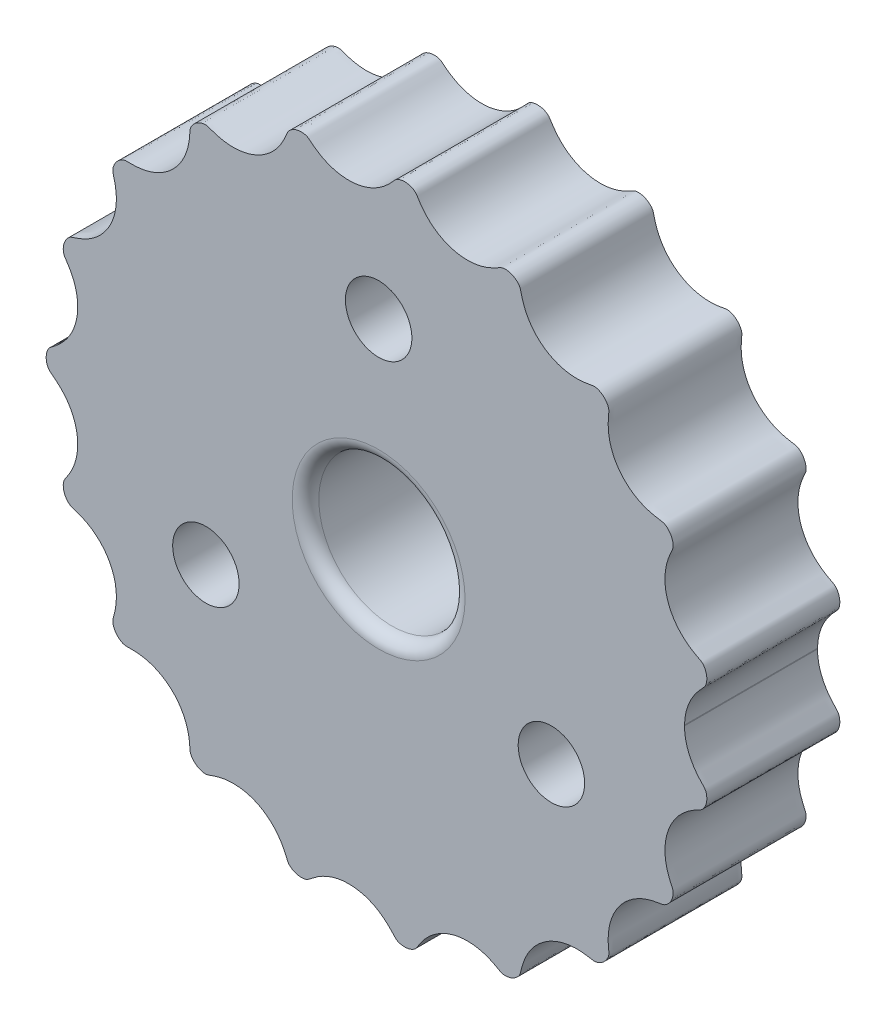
SolidWorks part; units mm, degrees
ref_plane "Ebene vorne" through (0, 0, 0) normal (0, 0, 1) x (1, 0, 0)
ref_plane "Ebene oben" through (0, 0, 0) normal (0, 1, 0) x (1, 0, 0)
ref_plane "Ebene rechts" through (0, 0, 0) normal (1, 0, 0) x (0, 0, -1)
sketch "Skizze1" plane through (0, 0, 0) normal (0, 0, 1) x (1, 0, 0)
  circle A0 centre (0, 0) radius 25
  dimension "D1" = 50
extrude "Aufsatz-Linear austragen1" add sketch "Skizze1" along normal blind 10 contours A0
sketch "Skizze3" plane through (0, 0, 10) normal (0, 0, 1) x (1, 0, 0)
  circle A0 centre (0, 25) radius 0.5
  circle A1 centre (0, 0) radius 25 construction
extrude "Schnitt-Linear austragen1" cut sketch "Skizze3" against normal up to next contours A0
pattern_circular "Kreismuster3" [suppressed] count 30 over 360
sketch "Skizze9" plane through (0, 0, 10) normal (0, 0, 1) x (1, 0, 0)
  line L0 (23.0004, 0.0609) -> (23, 0)
  spline S0 degree 4 number of poles 711 (21.8349, 10.4363) -> (21.8113, -10.3736) construction
  spline S1 degree 4 number of poles 634 (23, 0) -> (23.0004, 0.0609)
extrude "Schnitt-Linear austragen6" cut sketch "Skizze9" against normal blind 10 flip side to cut
sketch "Skizze21" plane through (0, 0, 0) normal (0, 0, -1) x (-1, 0, 0)
  circle A0 centre (0, 0) radius 5.5
  dimension "D1" = 11
extrude "Schnitt-Linear austragen11" cut sketch "Skizze21" against normal blind 10
sketch "Skizze22" plane through (0, 0, 0) normal (0, 0, -1) x (-1, 0, 0)
  circle A0 centre (0, 0) radius 15
  circle A1 centre (0, 15) radius 2.5
  circle A2 centre (12.9904, -7.5) radius 2.5
  circle A3 centre (-12.9904, -7.5) radius 2.5
  point P12 (0, 0)
  dimension "D1" = 3
  dimension "D2" = 5
fillet "Verrundung1" radius 1 2 edges at (-5.5, 0, 0) (-5.5, 0, 10)
extrude "Schnitt-Linear austragen12" cut sketch "Skizze22" against normal blind 10 contours A1 | A2 | A3
